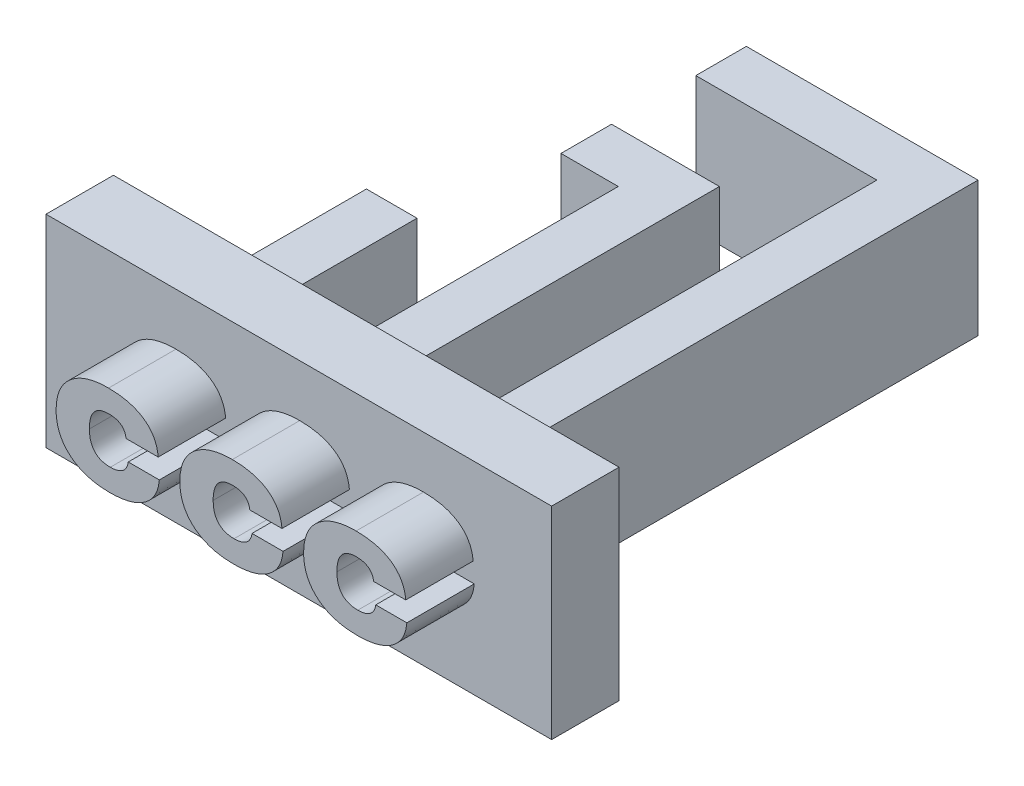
SolidWorks part; units mm, degrees
ref_plane "Front Plane" through (0, 0, 0) normal (0, 0, 1) x (1, 0, 0)
ref_plane "Top Plane" through (0, 0, 0) normal (0, 1, 0) x (1, 0, 0)
ref_plane "Right Plane" through (0, 0, 0) normal (1, 0, 0) x (0, 0, -1)
sketch "Sketch1" plane through (0, 0, 0) normal (0, 0, 1) x (1, 0, 0)
  line L1 (-7.5, 3) -> (7.5, 3)
  line L2 (-7.5, 3) -> (-7.5, -3)
  line L3 (-7.5, -3) -> (7.5, -3)
  line L4 (7.5, 3) -> (7.5, -3)
  line L5 (-7.5, 3) -> (7.5, -3) construction
  line L6 (-7.5, -3) -> (7.5, 3) construction
  point P0 (0, 0)
  dimension "D1" = 15
  dimension "D2" = 6
extrude "Boss-Extrude1" add sketch "Sketch1" along normal blind 2
sketch "Sketch2" plane through (0, 0, 2) normal (0, 0, 1) x (1, 0, 0)
  text T0 "CCC" font "Swis721 Blk BT" height in points 10
extrude "Boss-Extrude2" add sketch "Sketch2" along normal blind 2
sketch "Sketch3" plane through (0, 0, 0) normal (0, 1, 0) x (1, 0, 0)
  line L0 (7.5, 0) -> (-7.5, 0) construction
  line L1 (2.9487, 0) -> (4.4487, 0)
  line L2 (2.9487, 0) -> (2.9487, 12.2)
  line L3 (-3.644, -2) -> (-3.644, 5.3789) construction
  line L4 (4.4487, 0) -> (4.4487, 13.7)
  line L5 (-4.394, 0) -> (-2.894, 0)
  line L6 (-4.394, 0) -> (-4.394, 4.4)
  line L7 (0.0274, -2) -> (0.0274, 4.6797) construction
  line L8 (-2.894, 0) -> (-2.894, 4.4)
  line L9 (-2.894, 4.4) -> (-4.394, 4.4)
  line L10 (-0.7226, 0) -> (0.7774, 0)
  line L13 (-0.7226, 0) -> (-0.7226, 8.2)
  line L14 (3.6987, -2) -> (3.6987, 2.787) construction
  line L15 (0.7774, 0) -> (0.7774, 9.7)
  line L16 (0.7774, 9.7) -> (-2.4226, 9.7)
  line L17 (-2.4226, 13.7) -> (4.4487, 13.7)
  line L18 (-0.7226, 8.2) -> (-2.4226, 8.2)
  line L19 (-2.4226, 9.7) -> (-2.4226, 8.2)
  line L20 (-2.4226, 13.7) -> (-2.4226, 12.2)
  line L21 (-2.4226, 12.2) -> (2.9487, 12.2)
  dimension "D1" = 1.5
  dimension "D2" = 4.4
  dimension "D3" = 1.5
  dimension "D4" = 1.5
  dimension "D5" = 3.8
  dimension "D6" = 1.5
  dimension "D7" = 2.5
  dimension "D8" = 1.5
  dimension "D9" = 1.7
extrude "Boss-Extrude3" add sketch "Sketch3" along normal mid plane 4
